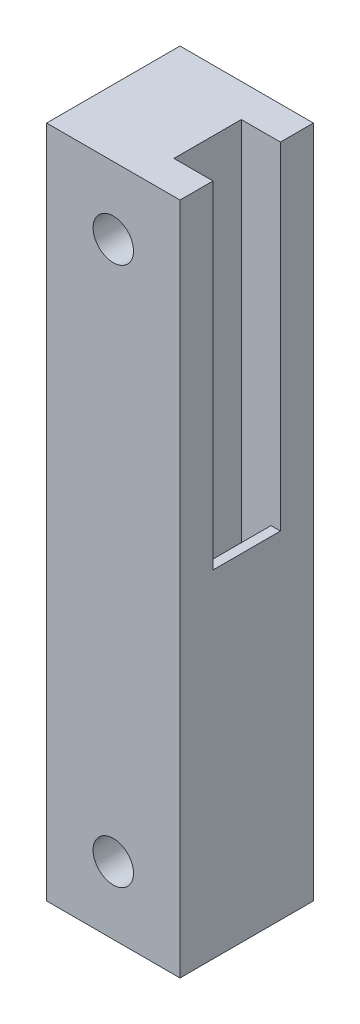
SolidWorks part; units mm, degrees
ref_plane "Спереди" through (0, 0, 0) normal (0, 0, 1) x (1, 0, 0)
ref_plane "Сверху" through (0, 0, 0) normal (0, 1, 0) x (1, 0, 0)
ref_plane "Справа" through (0, 0, 0) normal (1, 0, 0) x (0, 0, -1)
sketch "Эскиз1" plane through (0, 0, 0) normal (0, 1, 0) x (1, 0, 0)
  line L0 (2.3552, -5.0583) -> (2.3552, 4.8417) construction
  line L1 (4.1552, -5.0583) -> (-5.7448, -5.0583)
  line L2 (4.1552, -5.0583) -> (4.1552, 4.8417)
  line L3 (4.1552, 4.8417) -> (-5.7448, 4.8417)
  line L4 (-5.7448, -5.0583) -> (-5.7448, 4.8417)
  line L5 (-3.9448, -5.0583) -> (-3.9448, 4.8417) construction
  line L7 (1.2552, 2.3917) -> (3.4552, 2.3917)
  line L8 (1.2552, 2.3917) -> (1.2552, -2.6083)
  line L9 (1.2552, -2.6083) -> (3.4552, -2.6083)
  line L10 (3.4552, 2.3917) -> (3.4552, -2.6083)
  line L11 (1.2552, 2.3917) -> (3.4552, -2.6083) construction
  line L12 (1.2552, -2.6083) -> (3.4552, 2.3917) construction
  point P0 (0, 0)
  point P7 (0, 0)
  point P16 (2.3552, -0.1083)
  dimension "D6" = 5
  dimension "D7" = 2.2
  dimension "D2" = 9.9
  dimension "D8" = 1.8
  dimension "D9" = 1.8
extrude "Бобышка-Вытянуть1" add sketch "Эскиз1" along normal blind 50
sketch "Sketch2" plane through (0, 0, -4.8417) normal (0, 0, -1) x (-1, 0, 0)
  line L0 (0.7948, 50) -> (0.7948, 0) construction
  line L1 (-4.1552, 50) -> (5.7448, 50) construction
  line L2 (-4.1552, 0) -> (5.7448, 0) construction
  circle A0 centre (0.7948, 45) radius 1.5
  circle A1 centre (0.7948, 5) radius 1.5
  dimension "D2" = 3
  dimension "D3" = 40
  dimension "D1" = 5
extrude "Cut-Extrude2" cut sketch "Sketch2" against normal through all
sketch "Sketch4" plane through (0, 50, 0) normal (0, 1, 0) x (1, 0, 0)
  line L0 (1.2552, -2.6083) -> (4.1552, -2.6083)
  line L1 (4.1552, -5.0583) -> (4.1552, 4.8417) construction
  line L2 (4.1552, -2.6083) -> (4.1552, 2.3917)
  line L3 (4.1552, 2.3917) -> (1.2552, 2.3917)
  line L4 (1.2552, 2.3917) -> (1.2552, -2.6083)
  line L5 (3.4552, 2.3917) -> (1.2552, 2.3917) construction
extrude "Cut-Extrude4" cut sketch "Sketch4" against normal blind 25
